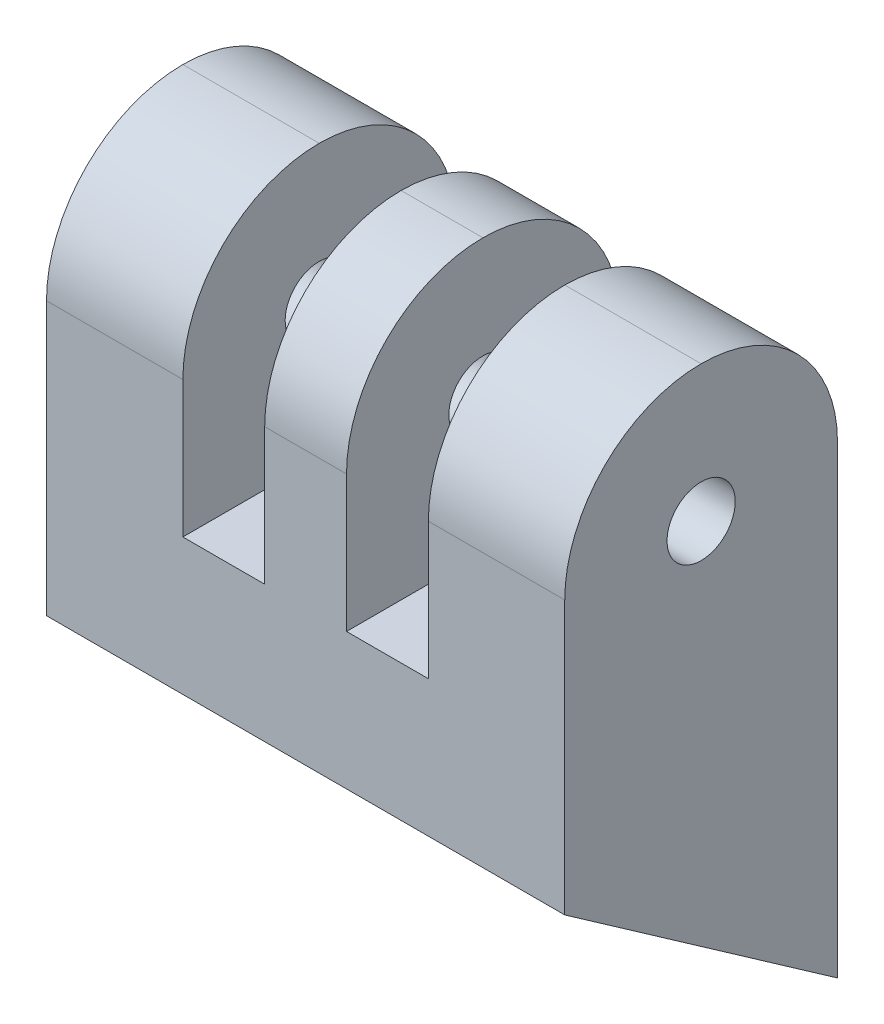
SolidWorks part; units mm, degrees
ref_plane "Front Plane" through (0, 0, 0) normal (0, 0, 1) x (1, 0, 0)
ref_plane "Top Plane" through (0, 0, 0) normal (0, 1, 0) x (1, 0, 0)
ref_plane "Right Plane" through (0, 0, 0) normal (1, 0, 0) x (0, 0, -1)
sketch "Sketch1" plane through (0, 0, 0) normal (0, 1, 0) x (1, 0, 0)
  line L1 (0, 0) -> (48.26, 0)
  line L2 (0, 0) -> (0, 25.4)
  line L3 (0, 25.4) -> (48.26, 25.4)
  line L4 (48.26, 0) -> (48.26, 25.4)
  dimension "D1" = 48.26
  dimension "D2" = 25.4
extrude "Boss-Extrude1" add sketch "Sketch1" along normal blind 12.7
sketch "Sketch2" plane through (0, 12.7, 0) normal (0, 1, 0) x (1, 0, 0)
  line L0 (0, 0) -> (48.26, 0) construction
  line L1 (0, 25.4) -> (12.7, 25.4)
  line L2 (0, 25.4) -> (0, 0)
  line L3 (0, 0) -> (12.7, 0)
  line L4 (12.7, 25.4) -> (12.7, 0)
  line L5 (48.26, 25.4) -> (0, 25.4) construction
  line L6 (48.26, 25.4) -> (35.56, 25.4)
  line L7 (48.26, 25.4) -> (48.26, 0)
  line L8 (48.26, 0) -> (35.56, 0)
  line L9 (35.56, 25.4) -> (35.56, 0)
  line L10 (20.32, 25.4) -> (27.94, 25.4)
  line L11 (20.32, 25.4) -> (20.32, 0)
  line L12 (20.32, 0) -> (27.94, 0)
  line L13 (27.94, 25.4) -> (27.94, 0)
  dimension "D1" = 12.7
  dimension "D2" = 12.7
  dimension "D3" = 7.62
  dimension "D4" = 7.62
extrude "Boss-Extrude2" add sketch "Sketch2" along normal blind 25.4
sketch "Sketch3" plane through (48.26, 0, 0) normal (1, 0, 0) x (0, 0, -1)
  line L0 (25.4, 38.1) -> (25.4, 0) construction
  line L1 (0, 38.1) -> (25.4, 38.1) construction
  circle A0 centre (12.7, 25.4) radius 3.175
  dimension "D1" = 6.35
  dimension "D2" = 12.7
  dimension "D3" = 12.7
extrude "Cut-Extrude1" cut sketch "Sketch3" against normal blind 59.69
sketch "Sketch4" plane through (48.26, 0, 0) normal (1, 0, 0) x (0, 0, -1)
  line L0 (0, 0) -> (25.4, -17.7853)
  line L1 (25.4, -17.7853) -> (25.4, 0)
  line L2 (25.4, 0) -> (0, 0)
  dimension "D1" = 90
  dimension "D2" = 35
extrude "Boss-Extrude3" add sketch "Sketch4" against normal blind 48.26
fillet "Fillet1" radius 12.7 6 edges at (6.35, 38.1, -25.4) (24.13, 38.1, -25.4) (41.91, 38.1, -25.4) (41.91, 38.1, 0) (24.13, 38.1, 0) (6.35, 38.1, 0)
ref_plane "Plane1" through (0, 10.4032, -7.2844) normal (0, -0.8192, 0.5736) x (-1, 0, 0)
